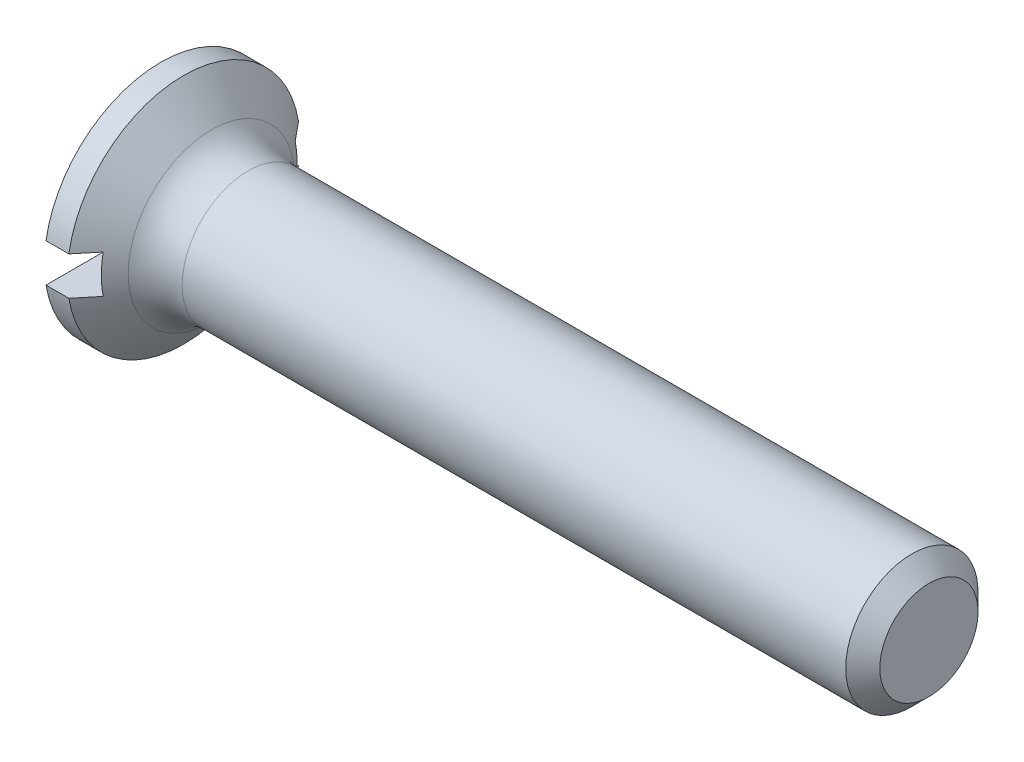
SolidWorks part; units mm, degrees
ref_plane "Plane1" through (0, 0, 0) normal (0, 0, 1) x (1, 0, 0)
ref_plane "Plane2" through (0, 0, 0) normal (0, 1, 0) x (1, 0, 0)
ref_plane "Plane3" through (0, 0, 0) normal (1, 0, 0) x (0, 0, -1)
sketch "BodySke" plane through (0, 0, 0) normal (0, 0, 1) x (1, 0, 0)
  line L0 (0, 1.2319) -> (0.2419, 1.2319)
  line L1 (0, 0) -> (0, 1.2319)
  line L2 (-25.4, 0) -> (25.4, 0) construction
  line L3 (8.128, 0) -> (0, 0)
  line L4 (0.6884, 0.6998) -> (7.9477, 0.6998)
  line L5 (8.128, 0.5194) -> (8.128, 0)
  line L6 (0.2419, 1.2319) -> (0.6884, 0.6998)
  line L7 (0.6884, 0.6998) -> (0, 1.5202) construction
  line L8 (7.9477, 0.6998) -> (8.128, 0.5194)
  line L9 (0.6884, -0.6998) -> (0, -1.5202) construction
  line L10 (0.8154, 1.2319) -> (0.8154, -0.2704) construction
  line L11 (5.7979, 1.2319) -> (5.7979, -0.2704) construction
  dimension "D1" = 0.6884
  dimension "Diameter" = 1.3995
  dimension "Length" = 8.128
  dimension "Head_dia" = 2.4638
  dimension "Minor_dia" = 1.0389
  dimension "D7" = 45
  dimension "Full_cone_dia" = 3.0404
  dimension "Head_angle" = 100
  dimension "Advance" = 0.254
  dimension "Thread_nom" = 2.3301
revolve "Base-Revolve" add sketch "BodySke"
fillet "Fillet1" radius 0.508 1 edges at (0.6884, 0, 0.6998)
sketch "Sketch2" plane through (0, 0, 0) normal (1, 0, 0) x (0, 0, -1)
  line L0 (1.2319, -0.2032) -> (-1.2319, -0.2032)
  line L1 (1.2319, -0.2032) -> (1.2319, 0.2032)
  line L2 (-1.2319, 0.2032) -> (1.2319, 0.2032)
  line L3 (-1.2319, 0.2032) -> (-1.2319, -0.2032)
  dimension "D1" = 2.4638
  dimension "D2" = 1.2319
  dimension "Slot_width" = 0.4064
  dimension "D3" = 0.2032
extrude "Slot" cut sketch "Sketch2" along normal blind 0.4064
sketch "ThdSchSke" plane through (0, 0, 0) normal (0, 0, 1) x (1, 0, 0)
  line L0 (5.7979, -0.5194) -> (5.6716, -0.6998)
  line L1 (5.7979, -0.5194) -> (5.9242, -0.6998)
  line L2 (5.9242, -0.6998) -> (5.9242, -0.8747)
  line L3 (-3.175, 0) -> (5.1513, 0) construction
  line L4 (0, -0.2032) -> (0, -1.2319) construction
  line L5 (5.9242, -0.8747) -> (5.6716, -0.8747)
  line L6 (5.6716, -0.8747) -> (5.6716, -0.6998)
  dimension "Thread_minor" = 1.0389
  dimension "Diameter" = 1.3995
  dimension "Start" = 5.7979
  dimension "SideAngle" = 55
  dimension "VeeAngle" = 70
  dimension "Overcut" = 1.7494
revolve "ThreadSchematic" [suppressed] cut sketch "ThdSchSke" angle 360 about L3
pattern_linear "ThdSchPat" [suppressed]
equation "\"D1@Sketch2\" = \"Head_dia@BodySke\""
equation "\"D2@Sketch2\" = \"D1@Sketch2\" / 2"
equation "\"D3@Sketch2\" = \"Slot_width@Sketch2\" / 2"
equation "\"Thread_minor@ThreadCosmetic\" = \"Minor_dia@BodySke\""
equation "\"Thread_length@ThreadCosmetic\" = ((sgn( (\"Length@BodySke\" - \"Advance@BodySke\" - ( ( ( \"Full_cone_dia@BodySke\" - \"Diameter@BodySke\" ) * 0.5 ) / tan( \"Head_angle@BodySke\" * 0.008726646 ) ) ) - \"Thread_n"
equation "\"Thread_minor@ThdSchSke\" = \"Minor_dia@BodySke\""
equation "\"Diameter@ThdSchSke\" = \"Diameter@BodySke\""
equation "\"Overcut@ThdSchSke\" = \"Diameter@BodySke\" * 1.25"
equation "\"Start@ThdSchSke\" = 0.000001 + \"Length@BodySke\" - \"Thread_length@ThreadCosmetic\"  '---Countersunk---"
equation "\"Num_threads@ThdSchPat\" = int( \"Thread_length@ThreadCosmetic\" / \"Advance@BodySke\" + 0.999 )  + 1"
equation "\"Advance@ThdSchPat\" = \"Thread_length@ThreadCosmetic\" /  (\"Num_threads@ThdSchPat\" - 1) 'relax it"
equation "\"Num_threads@ThdSchPat\" = \"Num_threads@ThdSchPat\" - sgn( \"Num_threads@ThdSchPat\" - 1) '---chamfered tips only---"
